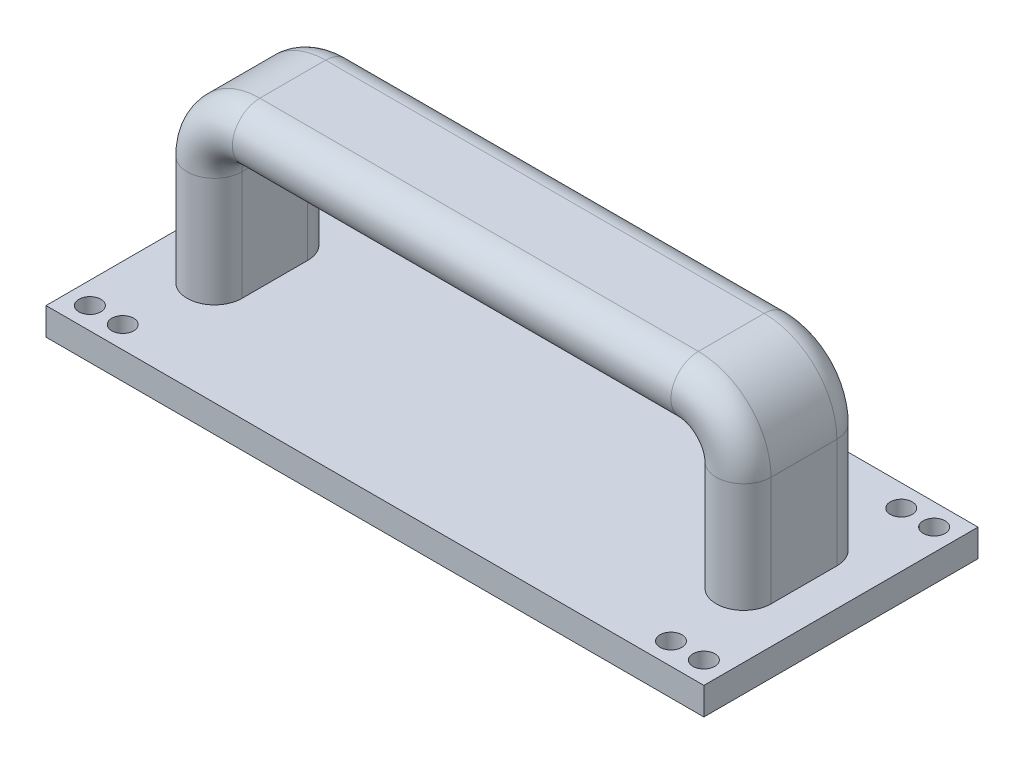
SolidWorks part; units mm, degrees
ref_plane "Front Plane" through (0, 0, 0) normal (0, 0, 1) x (1, 0, 0)
ref_plane "Top Plane" through (0, 0, 0) normal (0, 1, 0) x (1, 0, 0)
ref_plane "Right Plane" through (0, 0, 0) normal (1, 0, 0) x (0, 0, -1)
sketch "Sketch3" plane through (0, 0, 0) normal (0, 1, 0) x (1, 0, 0)
  line L1 (-60, -25) -> (60, -25)
  line L2 (-60, -25) -> (-60, 25)
  line L3 (-60, 25) -> (60, 25)
  line L4 (60, -25) -> (60, 25)
  line L5 (-60, -25) -> (60, 25) construction
  line L6 (-60, 25) -> (60, -25) construction
  point P0 (0, 0)
  dimension "D1" = 120
  dimension "D2" = 50
extrude "Boss-Extrude1" add sketch "Sketch3" along normal blind 5
sketch "Sketch4" plane through (0, 0, 0) normal (0, 0, 1) x (1, 0, 0)
  line L0 (-50, 5) -> (-50, 25)
  line L1 (-60, 5) -> (60, 5) construction
  line L2 (-40, 35) -> (40, 35)
  line L3 (0, 65.4422) -> (0, -12.7136) construction
  line L4 (50, 5) -> (50, 25)
  arc A0 (-50, 25) -> (-40, 35) centre (-40, 25) cw
  arc A1 (50, 25) -> (40, 35) centre (40, 25) ccw
  point P13 (0, 35)
  point P14 (0, 65.4422)
  dimension "D1" = 10
  dimension "D2" = 30
  dimension "D3" = 100
sketch "Sketch5" plane through (0, 5, 0) normal (0, 1, 0) x (1, 0, 0)
  line L1 (-60, 0) -> (0, 0) construction
  line L3 (-60, 25) -> (-60, -25) construction
  line L4 (-40, 0) -> (40, 0) construction
  line L5 (-48.2577, 6) -> (-48.2577, -6) construction
  line L6 (-43.2577, 6) -> (-43.2577, -6)
  line L7 (-53.2577, 6) -> (-53.2577, -6)
  arc A1 (-43.2577, 6) -> (-53.2577, 6) centre (-48.2577, 6) ccw
  arc A2 (-53.2577, -6) -> (-43.2577, -6) centre (-48.2577, -6) ccw
  point P8 (-48.2577, 0)
  point P13 (0, 0)
  dimension "D1" = 10
sweep "Sweep1" add profiles "Sketch5" path "Sketch4"
sketch "Sketch6" plane through (0, 5, 0) normal (0, 1, 0) x (1, 0, 0)
  line L0 (60, 25) -> (-60, 25) construction
  line L1 (-60, 25) -> (-60, -25) construction
  line L2 (0, 0) -> (-60, 0) construction
  line L3 (0, 25) -> (0, -25) construction
  line L4 (-60, -25) -> (60, -25) construction
  circle A0 centre (-56, 21) radius 2
  circle A1 centre (-50, 21) radius 2
  circle A2 centre (-50, -21) radius 2
  circle A3 centre (-56, -21) radius 2
  circle A4 centre (56, -21) radius 2
  circle A5 centre (50, -21) radius 2
  circle A6 centre (50, 21) radius 2
  circle A7 centre (56, 21) radius 2
  dimension "D1" = 4
  dimension "D2" = 4
  dimension "D3" = 4
  dimension "D5" = 42
  dimension "D6" = 100
  dimension "D7" = 6
  dimension "D4" = 2
extrude "Cut-Extrude1" cut sketch "Sketch6" against normal blind 5
